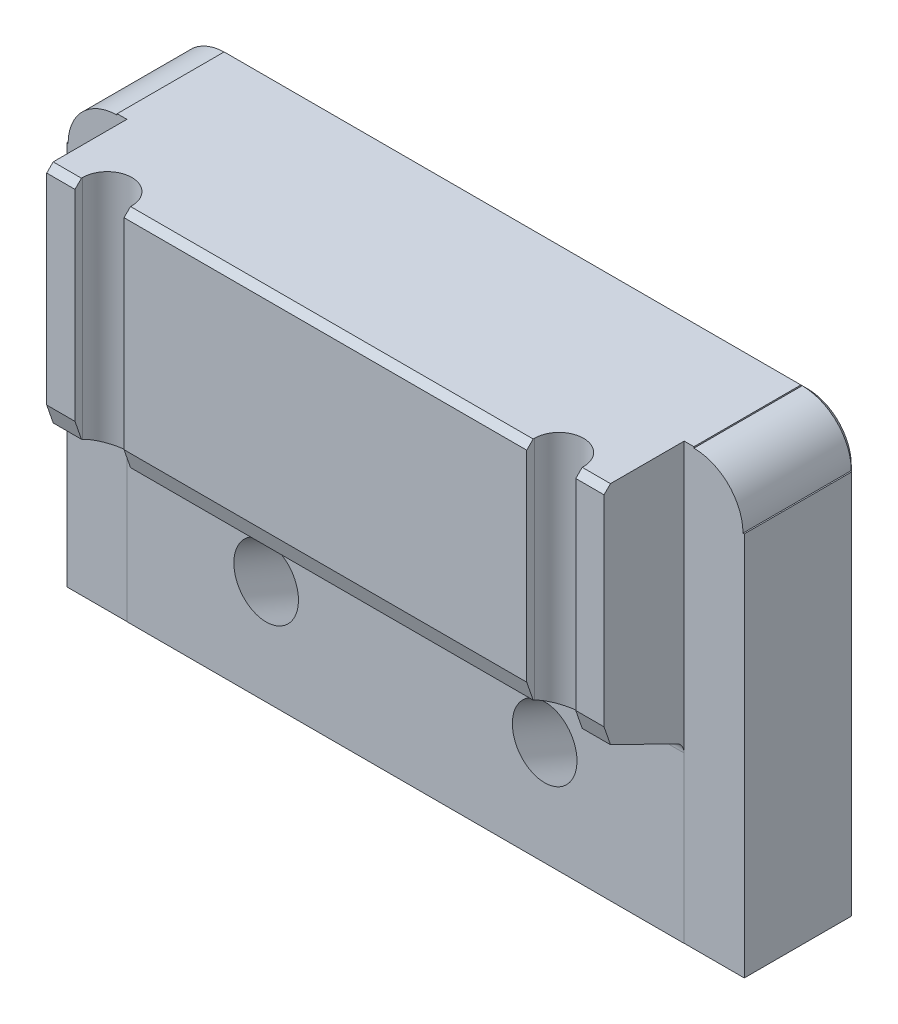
SolidWorks part; units mm, degrees
ref_plane "Front Plane" through (0, 0, 0) normal (0, 0, 1) x (1, 0, 0)
ref_plane "Top Plane" through (0, 0, 0) normal (0, 1, 0) x (1, 0, 0)
ref_plane "Right Plane" through (0, 0, 0) normal (1, 0, 0) x (0, 0, -1)
imported_body "Imported1"
other "Move Face1" parameters "D1"=32.512
